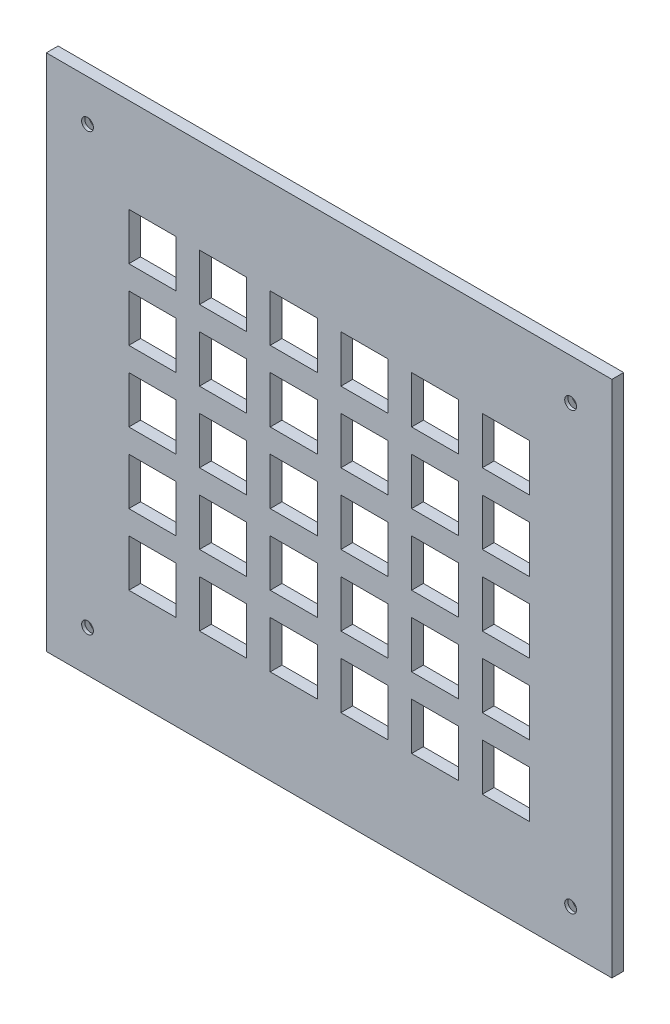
SolidWorks part; units mm, degrees
ref_plane "Front Plane" through (0, 0, 0) normal (0, 0, 1) x (1, 0, 0)
ref_plane "Top Plane" through (0, 0, 0) normal (0, 1, 0) x (1, 0, 0)
ref_plane "Right Plane" through (0, 0, 0) normal (1, 0, 0) x (0, 0, -1)
sketch "Sketch1" plane through (0, 0, 0) normal (0, 0, 1) x (1, 0, 0)
  line L1 (-76.2, 69.85) -> (76.2, 69.85)
  line L2 (-76.2, 69.85) -> (-76.2, -69.85)
  line L3 (-76.2, -69.85) -> (76.2, -69.85)
  line L4 (76.2, 69.85) -> (76.2, -69.85)
  line L5 (-76.2, 69.85) -> (76.2, -69.85) construction
  line L6 (-76.2, -69.85) -> (76.2, 69.85) construction
  point P0 (0, 0)
  dimension "D1" = 152.4
  dimension "D2" = 139.7
extrude "Boss-Extrude1" add sketch "Sketch1" along normal blind 3.175
sketch "Sketch3" plane through (0, 0, 3.175) normal (0, 0, 1) x (1, 0, 0)
  line L0 (-76.2, -69.85) -> (76.2, -69.85) construction
  line L1 (-53.975, -31.75) -> (-41.275, -31.75)
  line L2 (-53.975, -31.75) -> (-53.975, -44.45)
  line L3 (-53.975, -44.45) -> (-41.275, -44.45)
  line L4 (-41.275, -31.75) -> (-41.275, -44.45)
  line L5 (-53.975, -31.75) -> (-41.275, -44.45) construction
  line L6 (-53.975, -44.45) -> (-41.275, -31.75) construction
  line L7 (-76.2, 69.85) -> (-76.2, -69.85) construction
  line L8 (-34.925, -44.45) -> (-22.225, -44.45)
  line L9 (-22.225, -31.75) -> (-22.225, -44.45)
  line L10 (-34.925, -31.75) -> (-22.225, -31.75)
  line L11 (-34.925, -31.75) -> (-34.925, -44.45)
  line L12 (-15.875, -44.45) -> (-3.175, -44.45)
  line L13 (-3.175, -31.75) -> (-3.175, -44.45)
  line L14 (-15.875, -31.75) -> (-3.175, -31.75)
  line L15 (-15.875, -31.75) -> (-15.875, -44.45)
  line L16 (3.175, -44.45) -> (15.875, -44.45)
  line L17 (15.875, -31.75) -> (15.875, -44.45)
  line L18 (3.175, -31.75) -> (15.875, -31.75)
  line L19 (3.175, -31.75) -> (3.175, -44.45)
  line L20 (22.225, -44.45) -> (34.925, -44.45)
  line L21 (34.925, -31.75) -> (34.925, -44.45)
  line L22 (22.225, -31.75) -> (34.925, -31.75)
  line L23 (22.225, -31.75) -> (22.225, -44.45)
  line L24 (41.275, -44.45) -> (53.975, -44.45)
  line L25 (53.975, -31.75) -> (53.975, -44.45)
  line L26 (41.275, -31.75) -> (53.975, -31.75)
  line L27 (41.275, -31.75) -> (41.275, -44.45)
  line L28 (-34.925, -25.4) -> (-22.225, -25.4)
  line L29 (-22.225, -12.7) -> (-22.225, -25.4)
  line L30 (-34.925, -12.7) -> (-22.225, -12.7)
  line L31 (-34.925, -12.7) -> (-34.925, -25.4)
  line L32 (-15.875, -25.4) -> (-3.175, -25.4)
  line L33 (-3.175, -12.7) -> (-3.175, -25.4)
  line L34 (-15.875, -12.7) -> (-3.175, -12.7)
  line L35 (-15.875, -12.7) -> (-15.875, -25.4)
  line L36 (3.175, -25.4) -> (15.875, -25.4)
  line L37 (15.875, -12.7) -> (15.875, -25.4)
  line L38 (3.175, -12.7) -> (15.875, -12.7)
  line L39 (3.175, -12.7) -> (3.175, -25.4)
  line L40 (22.225, -25.4) -> (34.925, -25.4)
  line L41 (34.925, -12.7) -> (34.925, -25.4)
  line L42 (22.225, -12.7) -> (34.925, -12.7)
  line L43 (22.225, -12.7) -> (22.225, -25.4)
  line L44 (41.275, -25.4) -> (53.975, -25.4)
  line L45 (53.975, -12.7) -> (53.975, -25.4)
  line L46 (41.275, -12.7) -> (53.975, -12.7)
  line L47 (41.275, -12.7) -> (41.275, -25.4)
  line L48 (-34.925, -6.35) -> (-22.225, -6.35)
  line L49 (-22.225, 6.35) -> (-22.225, -6.35)
  line L50 (-34.925, 6.35) -> (-22.225, 6.35)
  line L51 (-34.925, 6.35) -> (-34.925, -6.35)
  line L52 (-15.875, -6.35) -> (-3.175, -6.35)
  line L53 (-3.175, 6.35) -> (-3.175, -6.35)
  line L54 (-15.875, 6.35) -> (-3.175, 6.35)
  line L55 (-15.875, 6.35) -> (-15.875, -6.35)
  line L56 (3.175, -6.35) -> (15.875, -6.35)
  line L57 (15.875, 6.35) -> (15.875, -6.35)
  line L58 (3.175, 6.35) -> (15.875, 6.35)
  line L59 (3.175, 6.35) -> (3.175, -6.35)
  line L60 (22.225, -6.35) -> (34.925, -6.35)
  line L61 (34.925, 6.35) -> (34.925, -6.35)
  line L62 (22.225, 6.35) -> (34.925, 6.35)
  line L63 (22.225, 6.35) -> (22.225, -6.35)
  line L64 (41.275, -6.35) -> (53.975, -6.35)
  line L65 (53.975, 6.35) -> (53.975, -6.35)
  line L66 (41.275, 6.35) -> (53.975, 6.35)
  line L67 (41.275, 6.35) -> (41.275, -6.35)
  line L68 (-34.925, 12.7) -> (-22.225, 12.7)
  line L69 (-22.225, 25.4) -> (-22.225, 12.7)
  line L70 (-34.925, 25.4) -> (-22.225, 25.4)
  line L71 (-34.925, 25.4) -> (-34.925, 12.7)
  line L72 (-15.875, 12.7) -> (-3.175, 12.7)
  line L73 (-3.175, 25.4) -> (-3.175, 12.7)
  line L74 (-15.875, 25.4) -> (-3.175, 25.4)
  line L75 (-15.875, 25.4) -> (-15.875, 12.7)
  line L76 (3.175, 12.7) -> (15.875, 12.7)
  line L77 (15.875, 25.4) -> (15.875, 12.7)
  line L78 (3.175, 25.4) -> (15.875, 25.4)
  line L79 (3.175, 25.4) -> (3.175, 12.7)
  line L80 (22.225, 12.7) -> (34.925, 12.7)
  line L81 (34.925, 25.4) -> (34.925, 12.7)
  line L82 (22.225, 25.4) -> (34.925, 25.4)
  line L83 (22.225, 25.4) -> (22.225, 12.7)
  line L84 (41.275, 12.7) -> (53.975, 12.7)
  line L85 (53.975, 25.4) -> (53.975, 12.7)
  line L86 (41.275, 25.4) -> (53.975, 25.4)
  line L87 (41.275, 25.4) -> (41.275, 12.7)
  line L88 (-34.925, 31.75) -> (-22.225, 31.75)
  line L89 (-22.225, 44.45) -> (-22.225, 31.75)
  line L90 (-34.925, 44.45) -> (-22.225, 44.45)
  line L91 (-34.925, 44.45) -> (-34.925, 31.75)
  line L92 (-15.875, 31.75) -> (-3.175, 31.75)
  line L93 (-3.175, 44.45) -> (-3.175, 31.75)
  line L94 (-15.875, 44.45) -> (-3.175, 44.45)
  line L95 (-15.875, 44.45) -> (-15.875, 31.75)
  line L96 (3.175, 31.75) -> (15.875, 31.75)
  line L97 (15.875, 44.45) -> (15.875, 31.75)
  line L98 (3.175, 44.45) -> (15.875, 44.45)
  line L99 (3.175, 44.45) -> (3.175, 31.75)
  line L100 (22.225, 31.75) -> (34.925, 31.75)
  line L101 (34.925, 44.45) -> (34.925, 31.75)
  line L102 (22.225, 44.45) -> (34.925, 44.45)
  line L103 (22.225, 44.45) -> (22.225, 31.75)
  line L104 (41.275, 31.75) -> (53.975, 31.75)
  line L105 (53.975, 44.45) -> (53.975, 31.75)
  line L106 (41.275, 44.45) -> (53.975, 44.45)
  line L107 (41.275, 44.45) -> (41.275, 31.75)
  line L108 (-53.975, -25.4) -> (-41.275, -25.4)
  line L109 (-41.275, -12.7) -> (-41.275, -25.4)
  line L110 (-53.975, -12.7) -> (-41.275, -12.7)
  line L111 (-53.975, -12.7) -> (-53.975, -25.4)
  line L112 (-53.975, -6.35) -> (-41.275, -6.35)
  line L113 (-41.275, 6.35) -> (-41.275, -6.35)
  line L114 (-53.975, 6.35) -> (-41.275, 6.35)
  line L115 (-53.975, 6.35) -> (-53.975, -6.35)
  line L116 (-53.975, 12.7) -> (-41.275, 12.7)
  line L117 (-41.275, 25.4) -> (-41.275, 12.7)
  line L118 (-53.975, 25.4) -> (-41.275, 25.4)
  line L119 (-53.975, 25.4) -> (-53.975, 12.7)
  line L120 (-53.975, 31.75) -> (-41.275, 31.75)
  line L121 (-41.275, 44.45) -> (-41.275, 31.75)
  line L122 (-53.975, 44.45) -> (-41.275, 44.45)
  line L123 (-53.975, 44.45) -> (-53.975, 31.75)
  point P0 (-47.625, -38.1)
  point P7 (-47.625, -44.45)
  dimension "D1" = 25.4
  dimension "D2" = 12.7
  dimension "D3" = 12.7
  dimension "D4" = 22.225
  dimension "D5" = 6
  dimension "D6" = 5
extrude "Cut-Extrude1" cut sketch "Sketch3" against normal through all
sketch "Sketch4" plane through (0, 0, 3.175) normal (0, 0, 1) x (1, 0, 0)
  line L0 (-76.2, -69.85) -> (76.2, 69.85) construction
  line L1 (-76.2, 69.85) -> (76.2, -69.85) construction
  line L2 (76.2, 69.85) -> (-76.2, 69.85) construction
  line L5 (-76.2, -69.85) -> (76.2, -69.85) construction
  point P8 (-65.8091, -60.325)
  point P9 (-65.8091, 60.325)
  point P10 (65.8091, 60.325)
  point P11 (65.8091, -60.325)
  dimension "D1" = 9.525
  dimension "D2" = 9.525
ref_plane "Plane1" through (0, -58.7248, 0) normal (0, -1, 0) x (-1, 0, 0)
sketch "Sketch5" plane through (0, -58.7248, 0) normal (0, -1, 0) x (-1, 0, 0)
  line L0 (-76.2, -3.175) -> (-76.2, 0) construction
  point P3 (-76.2, -1.5875)
  line B0 (-66.6653, -2.3294) -> (-66.6653, -7.4481)
  line B1 (-65.0748, -2.3294) -> (-66.6653, -2.3294) construction
  line B2 (-65.4121, -0.6553) -> (-64.7375, -0.6553) construction
  line B3 (-64.7375, -0.6553) -> (-64.7375, 0) construction
  line B4 (-65.4121, 0) -> (-65.4121, -0.6553) construction
  line B5 (-66.6653, -2.3294) -> (-68.2816, 0)
  line B6 (-66.2677, -7.8457) -> (-65.0748, -7.8457)
  line B7 (-66.6653, -7.4481) -> (-66.2677, -7.8457)
  line B8 (-65.0748, -7.8457) -> (-65.0748, 0)
  line B9 (-65.0748, 0) -> (-68.2816, 0)
  dimension "D1" = 11.1252
sketch_block_instance "screw-.1875-2_0-1"
sketch_block "screw-.1875-2_0" parameters "D1"=7.8457, "D2"=3.2068, "D3"=1.1929, "D4"=5.1187, "D5"=0.3976, "D6"=1.6163, "D7"=0.6553, "D8"=0.6745
revolve "Cut-Revolve1" cut sketch "Sketch5" angle 360 about L18
pattern_linear "LPattern1" count 2 spacing 130.175 along (-1, 0, 0) count 2 spacing 117.475 along (0, 1, 0) of "Cut-Revolve1"
